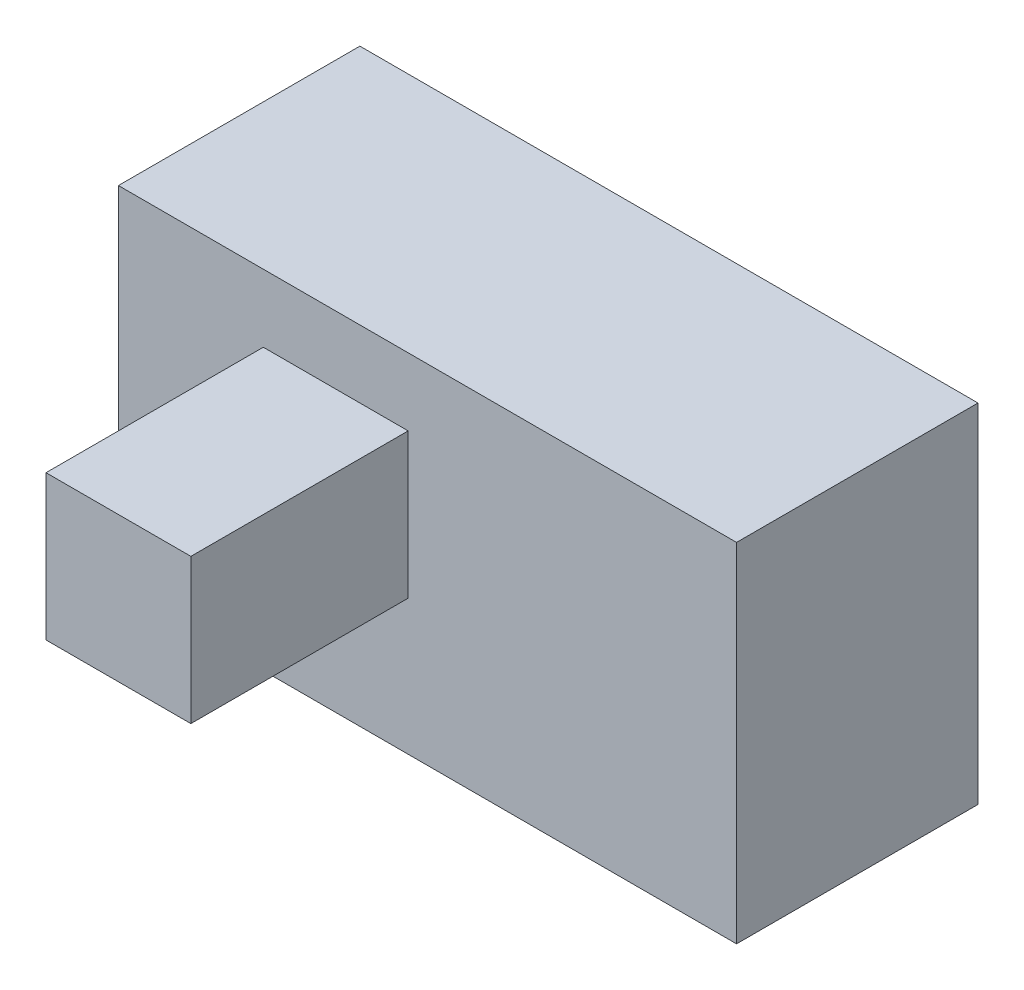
SolidWorks part; units mm, degrees
ref_plane "Plan1" through (0, 0, 0) normal (0, 0, 1) x (1, 0, 0)
ref_plane "Plan2" through (0, 0, 0) normal (0, 1, 0) x (1, 0, 0)
ref_plane "Plan3" through (0, 0, 0) normal (1, 0, 0) x (0, 0, -1)
sketch "Esquisse1" plane through (0, 0, 0) normal (0, 0, 1) x (1, 0, 0)
  line L0 (0, 0) -> (12.8, 0)
  line L1 (0, 0) -> (0, 7.2)
  line L2 (12.8, 7.2) -> (0, 7.2)
  line L3 (12.8, 7.2) -> (12.8, 0)
  dimension "D1" = 12.8
  dimension "D2" = 7.2
extrude "Base-Extrusion" add sketch "Esquisse1" along normal blind 5
sketch "Esquisse2" plane through (0, 0, 5) normal (0, 0, 1) x (1, 0, 0)
  line L0 (3, 5.8) -> (6, 5.8)
  line L1 (3, 5.8) -> (3, 2.8)
  line L2 (6, 2.8) -> (3, 2.8)
  line L3 (6, 2.8) -> (6, 5.8)
  line L4 (0, 0) -> (0, 7.2) construction
  line L5 (12.8, 7.2) -> (0, 7.2) construction
  dimension "D1" = 3
  dimension "D2" = 3
  dimension "D3" = 3
  dimension "D4" = 1.4
extrude "Boss.-Extru.1" add sketch "Esquisse2" along normal blind 4.5
sketch "Esquisse3" plane through (0, 0, 0) normal (0, 0, -1) x (-1, 0, 0)
  line L0 (0, 7.2) -> (-12.8, 0) construction
  circle A0 centre (-6.4, 3.6) radius 0.25
  dimension "D1" = 0.5
ref_plane "Plan5" through (5.55, 0, 0) normal (1, 0, 0) x (0, 0, -1)
sketch "Esquisse6" plane through (5.55, 0, 0) normal (1, 0, 0) x (0, 0, -1)
  line L0 (0, 3.6) -> (2.5809, 3.6)
sweep "Boss.-Balayage1" add profiles "Esquisse3" path "Esquisse6"
ref_plane "Plan6" through (6.82, 0, 0) normal (1, 0, 0) x (0, 0, -1)
mirror "Symétrie1" about plane through (6.82, 0, 0) normal (1, 0, 0) of "Boss.-Balayage1"
ref_plane "Plan8" through (4.28, 0, 0) normal (1, 0, 0) x (0, 0, -1)
mirror "Symétrie3" about plane through (4.28, 0, 0) normal (1, 0, 0) of "Boss.-Balayage1"
